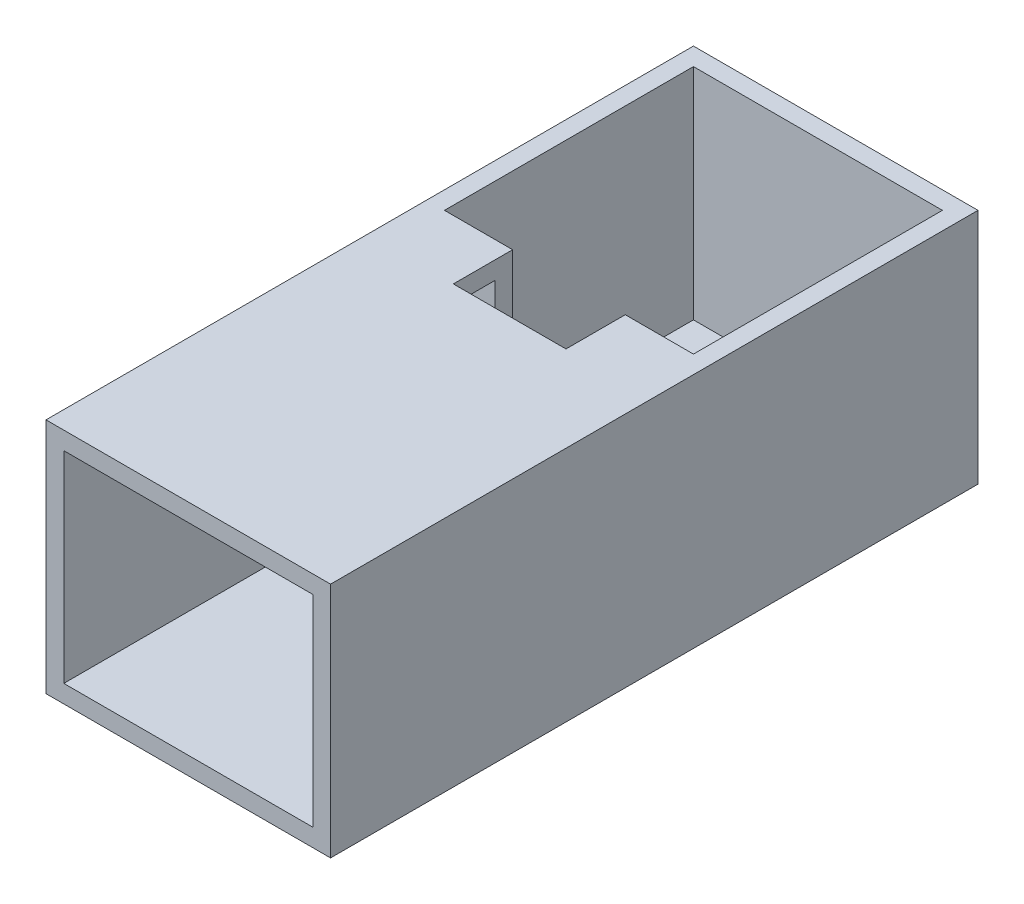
SolidWorks part; units mm, degrees
ref_plane "Alzado" through (0, 0, 0) normal (0, 0, 1) x (1, 0, 0)
ref_plane "Planta" through (0, 0, 0) normal (0, 1, 0) x (1, 0, 0)
ref_plane "Vista lateral" through (0, 0, 0) normal (1, 0, 0) x (0, 0, -1)
sketch "Croquis1" plane through (0, 0, 0) normal (0, 1, 0) x (1, 0, 0)
  line L1 (3.9972, 0) -> (37.0028, 0)
  line L2 (-0.5, 4.4972) -> (-0.5, 37.5028)
  line L3 (3.9972, 42) -> (37.0028, 42)
  line L4 (41.5, 4.4972) -> (41.5, 37.5028)
  line L5 (20.5, 42) -> (20.5, 35.7095) construction
  line L6 (41.5, 21) -> (31.2848, 21) construction
  line L10 (-0.5, 37.5028) -> (-0.5, 42)
  line L11 (-0.5, 42) -> (3.9972, 42)
  line L12 (37.0028, 42) -> (41.5, 42)
  line L13 (41.5, 42) -> (41.5, 37.5028)
  line L14 (37.0028, 0) -> (41.5, 0)
  line L15 (41.5, 0) -> (41.5, 4.4972)
  line L16 (-0.5, 4.4972) -> (-0.5, 0)
  line L17 (-0.5, 0) -> (3.9972, 0)
  dimension "D1" = 42
  dimension "D2" = 42
  dimension "D3" = 6.36
extrude "Saliente-Extruir1" add sketch "Croquis1" along normal blind 3
sketch "Croquis4" plane through (0, 0, 0) normal (0, 1, 0) x (1, 0, 0)
  line L3 (-3.5, -3) -> (-3.5, 45)
  line L4 (-0.5, 0) -> (11.5, 0)
  line L7 (-0.5, 0) -> (-0.5, 42)
  line L9 (-0.5, 42) -> (41.5, 42)
  line L10 (41.5, 0) -> (41.5, 42)
  line L48 (-3.5, 45) -> (44.5, 45)
  line L49 (44.5, -3) -> (44.5, 45)
  line L50 (-3.5, -3) -> (11.5, -3)
  line L51 (20.5, 42) -> (20.5, 34.6523) construction
  line L54 (29.5, -3) -> (44.5, -3)
  line L55 (-3.5, -3) -> (44.5, -3) construction
  line L56 (29.5, 0) -> (41.5, 0)
  line L57 (-0.5, 0) -> (41.5, 0) construction
  line L58 (11.5, 0) -> (29.5, 0)
  line L59 (29.5, -3) -> (11.5, -3)
  dimension "D1" = 3
extrude "Saliente-Extruir4" add sketch "Croquis4" along normal blind 40
ref_plane "Plano5" through (0, 0, 0) normal (0, 0, -1) x (-1, 0, 0)
sketch "Croquis5" plane through (0, 0, 0) normal (0, 0, -1) x (-1, 0, 0)
  line L0 (-44.5, 0) -> (3.5, 0) construction
  line L1 (-29, 15) -> (-11, 15)
  line L2 (-29, 15) -> (-29, 3)
  line L3 (-29, 3) -> (-11, 3)
  line L4 (-11, 15) -> (-11, 3)
  line L5 (3.5, 40) -> (3.5, 0) construction
  point P8 (-20, 3)
  dimension "D1" = 3
  dimension "D2" = 23.5
  dimension "D3" = 12
  dimension "D4" = 18
ref_plane "Plano6" through (0, 0, 3) normal (0, 0, 1) x (1, 0, 0)
sketch "Croquis6" plane through (0, 0, 3) normal (0, 0, 1) x (1, 0, 0)
  line L0 (-0.5, 37) -> (-0.5, 3)
  line L1 (-3.5, 40) -> (44.5, 40)
  line L2 (-3.5, 40) -> (-3.5, 0)
  line L3 (-3.5, 0) -> (44.5, 0)
  line L4 (44.5, 40) -> (44.5, 0)
  line L5 (-0.5, 3) -> (41.5, 3)
  line L6 (41.5, 37) -> (41.5, 3)
  line L7 (-0.5, 37) -> (41.5, 37)
  dimension "D1" = 3
extrude "Saliente-Extruir5" add sketch "Croquis6" along normal blind 61.21
ref_plane "Plano7" through (0, 40, 0) normal (0, 1, 0) x (1, 0, 0)
sketch "Croquis7" plane through (0, 40, 0) normal (0, 1, 0) x (1, 0, 0)
  line L0 (29, 0) -> (11, 0) construction
  line L1 (11, 0) -> (30, 0)
  line L2 (11, 0) -> (11, -10)
  line L3 (11, -10) -> (30, -10)
  line L4 (30, 0) -> (30, -10)
  line L5 (-0.5, 42) -> (-0.5, 0) construction
  point P6 (20.5, 0)
  dimension "D1" = 21
  dimension "D2" = 19
  dimension "D3" = 10
extrude "Cortar-Extruir1" cut sketch "Croquis7" against normal up to surface (37 mm away)
